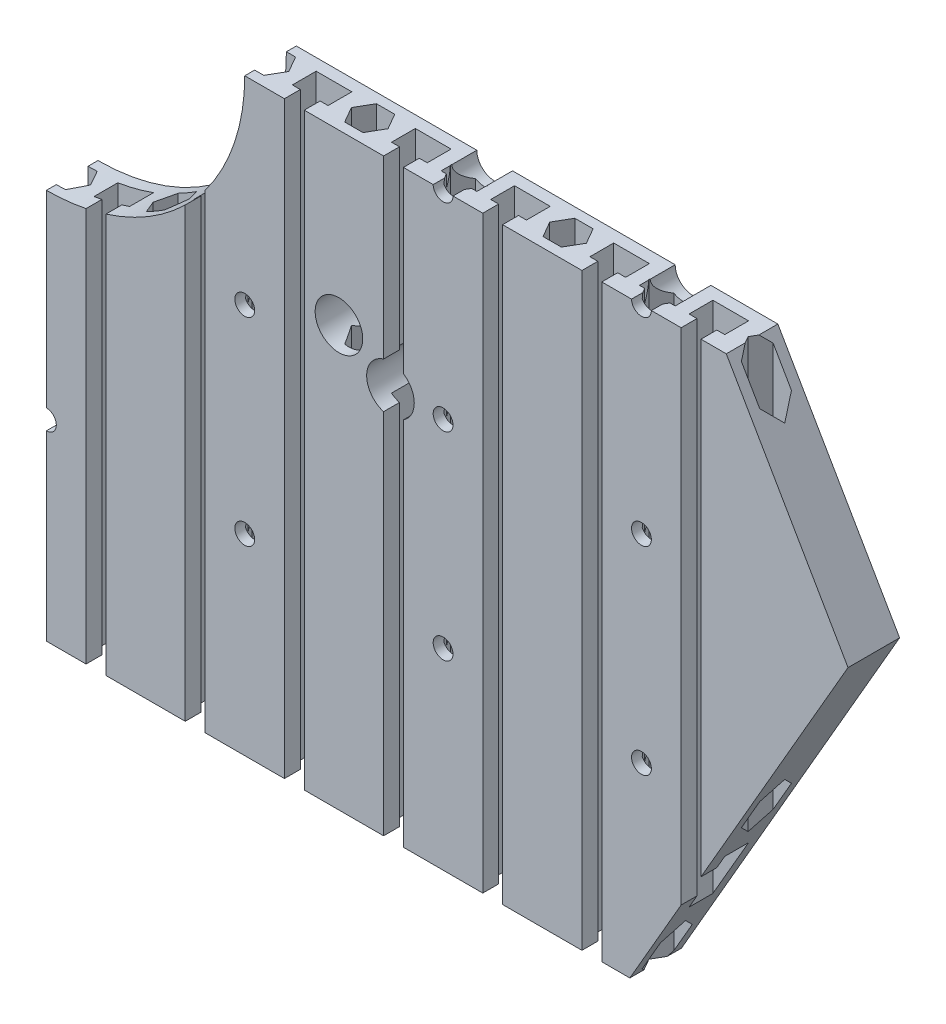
SolidWorks part; units mm, degrees
ref_plane "Plan de face" through (0, 0, 0) normal (0, 0, 1) x (1, 0, 0)
ref_plane "Plan de dessus" through (0, 0, 0) normal (0, 1, 0) x (1, 0, 0)
ref_plane "Plan de droite" through (0, 0, 0) normal (1, 0, 0) x (0, 0, -1)
sketch "Esquisse1" plane through (0, 0, 0) normal (0, 0, 1) x (1, 0, 0)
  line L6 (35.7636, 358.7862) -> (-423.8647, -437.3133) construction
  line L7 (-755.4678, -148.4209) -> (879.7592, -148.4209) construction
  line L8 (-46.1325, 376.7457) -> (415.4529, -422.7436) construction
  line L9 (257.0726, -148.4209) -> (-245.0999, 141.5085) construction
  line L10 (-257.0726, -148.4209) -> (263.2247, 151.9729) construction
  line L11 (-55, 201.5791) -> (55, 201.5791)
  line L12 (-147.0726, -148.4209) -> (147.0726, -148.4209)
  line L13 (147.0726, -148.4209) -> (202.0726, -53.1581)
  line L14 (202.0726, -53.1581) -> (55, 201.5791)
  line L15 (-147.0726, -148.4209) -> (-202.0726, -53.1581)
  line L16 (-202.0726, -53.1581) -> (-55, 201.5791)
  dimension "D1" = 60
  dimension "D2" = 60
  dimension "D3" = 110
  dimension "D4" = 350
  dimension "D5" = 60
  dimension "D6" = 60
  dimension "D7" = 110
  dimension "D8" = 110
extrude "Boss.-Extru.2" add sketch "Esquisse1" along normal blind 13
sketch "Esquisse3" plane through (0, 201.5791, 0) normal (0, 1, 0) x (1, 0, 0)
  line L0 (-12.5, 6.793) -> (-12.5, -19.2478) construction
  line L1 (-8, -3) -> (-17, -3)
  line L2 (-17, -3) -> (-17, -9)
  line L3 (-17, -9) -> (-15, -9)
  line L4 (-15, -9) -> (-15, -13)
  line L5 (55, -13) -> (-55, -13) construction
  line L6 (-10, -9) -> (-10, -13)
  line L7 (-8, -9) -> (-10, -9)
  line L8 (-8, -3) -> (-8, -9)
  line L9 (-15, -13) -> (-10, -13)
  point P2 (-12.5, -13)
  point P14 (-12.5, -3)
  dimension "D1" = 12.5
  dimension "D2" = 9
  dimension "D3" = 5
  dimension "D4" = 6
  dimension "D5" = 4
extrude "Enlèv. mat.-Extru.1" cut sketch "Esquisse3" against normal up to next
pattern_linear "Répétition linéaire1" count 8 spacing 25 along (1, 0, 0) of "Enlèv. mat.-Extru.1"
pattern_linear "Répétition linéaire2" count 7 spacing 25 along (-1, 0, 0) of "Enlèv. mat.-Extru.1"
sketch "3parties" plane through (0, 0, 0) normal (0, 0, 1) x (1, 0, 0)
  line L0 (-147.0726, -148.4209) -> (147.0726, -148.4209) construction
  line L1 (147.0726, -148.4209) -> (202.0726, -53.1581) construction
  line L2 (-50, 0) -> (-171.3817, 0)
  line L3 (-165, 11.0535) -> (-202.0726, -53.1581) construction
  line L4 (50, 0) -> (171.3817, 0)
  line L5 (202.0726, -53.1581) -> (165, 11.0535) construction
  line L6 (0, -50) -> (0, -148.4209)
  line L7 (-10, -148.4209) -> (10, -148.4209) construction
  line L8 (202.0726, -53.1581) -> (55, 201.5791) construction
  line L9 (-55, 201.5791) -> (55, 201.5791) construction
  line L10 (-202.0726, -53.1581) -> (-55, 201.5791) construction
  line L11 (-147.0726, -148.4209) -> (147.0726, -148.4209)
  line L12 (147.0726, -148.4209) -> (202.0726, -53.1581)
  line L13 (202.0726, -53.1581) -> (55, 201.5791)
  line L14 (-55, 201.5791) -> (55, 201.5791)
  line L15 (-202.0726, -53.1581) -> (-55, 201.5791)
  circle A0 centre (0, 0) radius 50
  dimension "D1" = 100
sketch "certcleRotules" plane through (0, 0, 13) normal (0, 0, 1) x (1, 0, 0)
  circle A0 centre (0, 0) radius 157.5
  dimension "D1" = 315
sketch "Esquisse6" plane through (0, 0, 0) normal (0, 1, 0) x (1, 0, 0)
  line L0 (-157.5, -13) -> (157.5, -13) construction
  line L1 (0, 0) -> (-4.5, 0)
  line L2 (0, 0) -> (0, -13)
  line L3 (-2.5, -9) -> (-4.5, -9)
  line L4 (-4.5, 0) -> (-4.5, -9)
  line L7 (0, -13) -> (-2.5, -13)
  line L8 (-2.5, -9) -> (-2.5, -13)
  dimension "D1" = 4.5
  dimension "D2" = 2.5
  dimension "D3" = 4
revolve "Enlèvement de matière-Révolution1" cut sketch "Esquisse6" angle 360 about L2
pattern_linear "Répétition linéaire3" count 4 spacing 50 along (0, 1, 0) count 4 spacing 50 along (1, 0, 0) of "Enlèvement de matière-Révolution1"
pattern_linear "Répétition linéaire5" count 3 spacing 50 along (0, -1, 0) count 4 spacing 50 along (1, 0, 0) of "Enlèvement de matière-Révolution1"
pattern_linear "Répétition linéaire6" count 4 spacing 50 along (0, 1, 0) count 4 spacing 50 along (-1, 0, 0) of "Enlèvement de matière-Révolution1"
pattern_linear "Répétition linéaire7" count 3 spacing 50 along (0, -1, 0) count 4 spacing 50 along (-1, 0, 0) of "Enlèvement de matière-Révolution1"
sketch "Esquisse8" plane through (0, 0, 0) normal (0, 0, -1) x (-1, 0, 0)
  circle A0 centre (0, 100) radius 4.5 construction
  circle A1 centre (0, 100) radius 4.5
extrude "bouchonBarreauHaut" add sketch "Esquisse8" against normal blind 13
sketch "Esquisse7" plane through (0, 0, 0) normal (0, 0, -1) x (-1, 0, 0)
  line L1 (-6.5, 105.15) -> (6.5, 105.15)
  line L2 (-6.5, 105.15) -> (-6.5, 80.15)
  line L3 (-6.5, 80.15) -> (6.5, 80.15)
  line L4 (6.5, 105.15) -> (6.5, 80.15)
  line L5 (0, 9.9) -> (0, -9.9) construction
  dimension "D1" = 25
  dimension "D2" = 80.15
  dimension "D3" = 13
  dimension "D4" = 6.5
extrude "Boss.-Extru.4" add sketch "Esquisse7" along normal blind 5
sketch "Esquisse9" plane through (0, 0, 0) normal (1, 0, 0) x (0, 0, -1)
  line L0 (5, 80.15) -> (0, 80.15) construction
  line L1 (5, 80.15) -> (5, 105.15) construction
  line L3 (5, 85.15) -> (5, 82.5)
  line L4 (5, 82.5) -> (-3, 82.5)
  line L6 (-3, -148.4209) -> (-3, 201.5791) construction
  line L7 (-13, 157.5) -> (-13, -157.5) construction
  line L8 (-3, 79.15) -> (-13, 79.15)
  line L9 (-3, 79.15) -> (-3, 82.5)
  line L10 (5, 85.15) -> (-13, 85.15)
  line L11 (-13, 79.15) -> (-13, 85.15)
  dimension "D1" = 5
  dimension "D2" = 2.65
  dimension "D3" = 6
revolve "Enlèvement de matière-Révolution2" cut sketch "Esquisse9" angle 360 about L10
pattern_linear "Répétition linéaire8" count 2 spacing 15 along (0, 1, 0) of "Enlèvement de matière-Révolution2"
pattern_circular "Répétition circulaire1" count 3 every 120 about axis through (0, 0, 0) along (0, 0, 1) of "Boss.-Extru.4", "Enlèvement de matière-Révolution2", "Répétition linéaire8"
sketch "Esquisse10" plane through (0, 0, 0) normal (1, 0, 0) x (0, 0, -1)
  line L0 (0, 201.5791) -> (0, -53.1581) construction
  line L1 (0, 77.5) -> (5, 77.5)
  line L2 (0, 77.5) -> (0, 72.5)
  line L3 (0, 72.5) -> (5, 72.5)
  line L4 (5, 77.5) -> (5, 72.5)
  line L5 (0, 50) -> (0, -50) construction
  line L6 (0, -72.5) -> (5, -72.5)
  line L7 (0, -72.5) -> (0, -77.5)
  line L8 (0, -77.5) -> (5, -77.5)
  line L9 (5, -72.5) -> (5, -77.5)
  line L10 (5, 80.15) -> (5, 105.15) construction
  line L11 (-9, 50) -> (0, 50) construction
  line L13 (-9, -100) -> (0, -100) construction
  point P16 (2.5, 72.5)
  point P19 (2.5, -72.5)
  dimension "D1" = 22.5
  dimension "D2" = 5
  dimension "D3" = 22.5
  dimension "D4" = 5
extrude "Boss.-Extru.6" add sketch "Esquisse10" along normal mid plane 250
chamfer "Chanfrein1" distance 5 angle 60 4 edges at (125, -75, -5) (-125, -75, -5) (-125, 75, -5) (125, 75, -5)
sketch "Esquisse11" plane through (0, 0, 13) normal (0, 0, 1) x (1, 0, 0)
  line L0 (-10, -148.4209) -> (-10, 201.5791) construction
  line L1 (-10, 23.5) -> (10, 23.5)
  line L2 (-10, 23.5) -> (-10, -23.5)
  line L3 (-10, -23.5) -> (10, -23.5)
  line L4 (10, 23.5) -> (10, -23.5)
  line L5 (10, -148.4209) -> (10, 201.5791) construction
  dimension "D1" = 47
  dimension "D2" = 23.5
extrude "Enlèv. mat.-Extru.2" cut sketch "Esquisse11" against normal blind 8.9
sketch "Esquisse13" plane through (-8, 0, 0) normal (-1, 0, 0) x (0, 0, 1)
  line L1 (4.1, -23.5) -> (11.1, -23.5)
  line L2 (4.1, -23.5) -> (4.1, -40)
  line L3 (4.1, -40) -> (6.1, -40)
  line L4 (11.1, -23.5) -> (11.1, -35)
  arc A0 (6.1, -40) -> (11.1, -35) centre (6.1, -35) ccw
  dimension "D2" = 5
  dimension "D1" = 16.5
  dimension "D3" = 7
extrude "Enlèv. mat.-Extru.3" cut sketch "Esquisse13" against normal up to surface (16 mm away)
sketch "Esquisse14" plane through (0, 0, 4.1) normal (0, 0, 1) x (1, 0, 0)
  line L0 (-8, 23.5) -> (-8, -40) construction
  line L1 (-3, -20) -> (3, -20)
  line L2 (-8, -25) -> (-8, -35)
  line L3 (-3, -40) -> (3, -40)
  line L4 (8, -25) -> (8, -35)
  line L5 (8, -40) -> (8, 23.5) construction
  line L6 (8, -40) -> (-8, -40) construction
  arc A0 (-8, -35) -> (-3, -40) centre (-3, -35) ccw
  arc A1 (3, -40) -> (8, -35) centre (3, -35) ccw
  arc A2 (3, -20) -> (8, -25) centre (3, -25) cw
  arc A3 (-3, -20) -> (-8, -25) centre (-3, -25) ccw
  point P16 (8, -20)
  point P19 (-8, -20)
  dimension "D3" = 5
  dimension "D1" = 20
extrude "Enlèv. mat.-Extru.4" cut sketch "Esquisse14" against normal up to next
mirror "Symétrie1" about plane through (0, 0, 0) normal (0, 1, 0) of "Enlèv. mat.-Extru.4", "Enlèv. mat.-Extru.3"
sketch "Esquisse15" plane through (0, 0, 0) normal (0, 0, -1) x (-1, 0, 0)
  circle A0 centre (-50, 0) radius 4.5 construction
  circle A1 centre (0, -50) radius 4.5 construction
  circle A2 centre (50, 0) radius 4.5 construction
  circle A3 centre (0, 50) radius 4.5 construction
  circle A4 centre (-50, 0) radius 4.5
  circle A5 centre (0, -50) radius 4.5
  circle A6 centre (50, 0) radius 4.5
  circle A7 centre (0, 50) radius 4.5
extrude "boucheTrousCEntre" add sketch "Esquisse15" against normal up to surface (13 mm away)
sketch "Esquisse16" plane through (0, -148.4209, 0) normal (0, -1, 0) x (1, 0, 0)
  line L0 (0, -9.9) -> (0, 9.9) construction
  line L1 (-2.3094, 2.5) -> (2.3094, 2.5)
  line L2 (2.3094, 2.5) -> (4.6188, 6.5)
  line L3 (4.6188, 6.5) -> (2.3094, 10.5)
  line L4 (2.3094, 10.5) -> (-2.3094, 10.5)
  line L5 (-2.3094, 10.5) -> (-4.6188, 6.5)
  line L6 (-4.6188, 6.5) -> (-2.3094, 2.5)
  line L8 (-10, 13) -> (10, 13) construction
  circle A0 centre (0, 6.5) radius 4 construction
  dimension "D1" = 6.5
  dimension "D2" = 8
extrude "Enlèv. mat.-Extru.5" cut sketch "Esquisse16" against normal through all
pattern_linear "Répétition linéaire9" count 8 spacing 25 along (1, 0, 0) of "Enlèv. mat.-Extru.5"
pattern_linear "Répétition linéaire10" count 8 spacing 25 along (-1, 0, 0) of "Enlèv. mat.-Extru.5"
sketch "Esquisse20" plane through (0, 0, 0) normal (0, 0, 1) x (1, 0, 0)
  line L0 (-50, 0) -> (-171.3817, 0) construction
  line L1 (-202.0726, -53.1581) -> (-55, 201.5791) construction
  line L2 (-55, 201.5791) -> (55, 201.5791) construction
  line L3 (202.0726, -53.1581) -> (55, 201.5791) construction
  line L4 (147.0726, -148.4209) -> (202.0726, -53.1581) construction
  line L5 (-147.0726, -148.4209) -> (147.0726, -148.4209) construction
  line L6 (0, -50) -> (0, -148.4209) construction
  line L7 (-50, 0) -> (-171.3817, 0)
  line L8 (-171.3817, 0) -> (-55, 201.5791)
  line L9 (-55, 201.5791) -> (55, 201.5791)
  line L10 (202.0726, -53.1581) -> (55, 201.5791)
  line L11 (147.0726, -148.4209) -> (202.0726, -53.1581)
  line L12 (0, -148.4209) -> (147.0726, -148.4209)
  line L13 (0, -50) -> (0, -148.4209)
  circle A0 centre (0, 0) radius 50 construction
  arc A1 (-50, 0) -> (0, -50) centre (0, 0) ccw
sketch "Esquisse22" plane through (0, 0, 0) normal (0, 0, 1) x (1, 0, 0)
  line L0 (-147.0726, -148.4209) -> (-202.0726, -53.1581) construction
  line L1 (-202.0726, -53.1581) -> (-55, 201.5791) construction
  line L2 (-55, 201.5791) -> (55, 201.5791) construction
  line L3 (202.0726, -53.1581) -> (55, 201.5791) construction
  line L4 (50, 0) -> (171.3817, 0) construction
  line L5 (0, -50) -> (0, -148.4209) construction
  line L6 (-147.0726, -148.4209) -> (147.0726, -148.4209) construction
  line L7 (-147.0726, -148.4209) -> (-202.0726, -53.1581)
  line L8 (-202.0726, -53.1581) -> (-55, 201.5791)
  line L9 (-55, 201.5791) -> (55, 201.5791)
  line L10 (171.3817, 0) -> (55, 201.5791)
  line L11 (50, 0) -> (171.3817, 0)
  line L12 (0, -50) -> (0, -148.4209)
  line L13 (-147.0726, -148.4209) -> (0, -148.4209)
  circle A0 centre (0, 0) radius 50 construction
  arc A1 (0, -50) -> (50, 0) centre (0, 0) ccw
extrude "Enlèv. mat.-Extru.9" cut sketch "Esquisse22" against normal through all both and the other way through all
